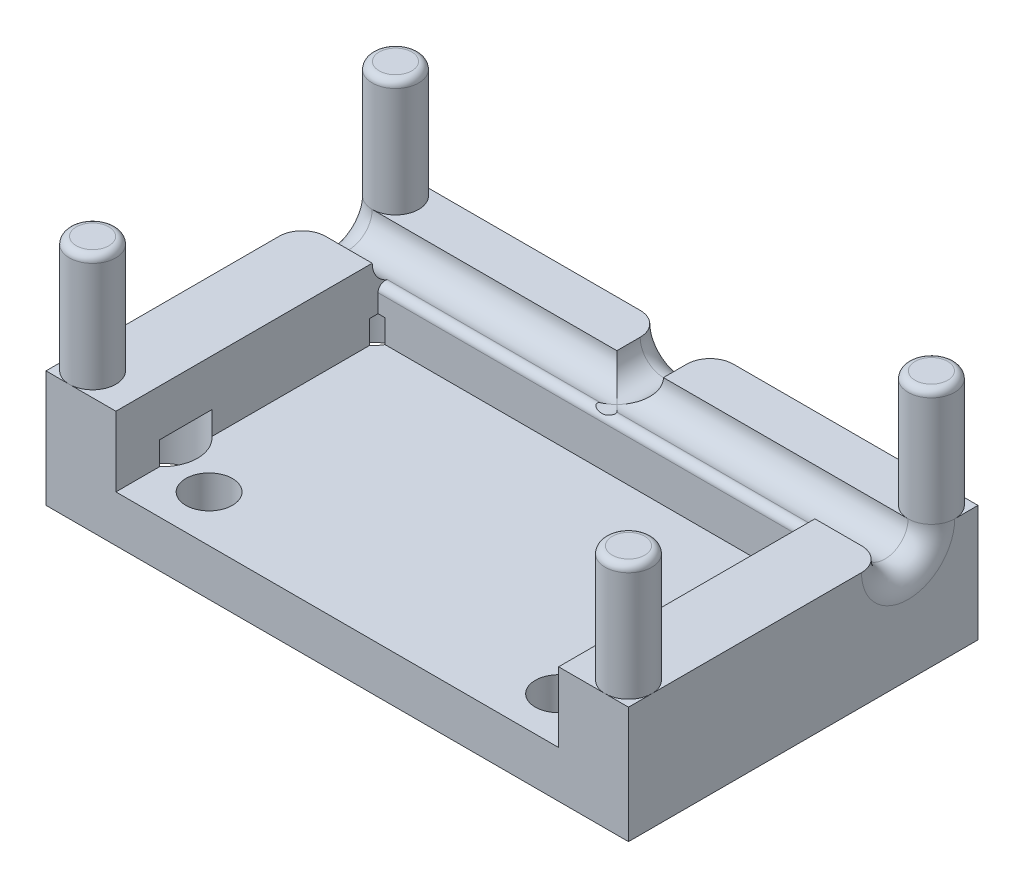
SolidWorks part; units mm, degrees
ref_plane "Front Plane" through (0, 0, 0) normal (0, 0, 1) x (1, 0, 0)
ref_plane "Top Plane" through (0, 0, 0) normal (0, 1, 0) x (1, 0, 0)
ref_plane "Right Plane" through (0, 0, 0) normal (1, 0, 0) x (0, 0, -1)
sketch "Sketch1" plane through (0, 0, 0) normal (0, 1, 0) x (1, 0, 0)
  line L1 (12.5, -7.5) -> (-12.5, -7.5)
  line L2 (12.5, -7.5) -> (12.5, 7.5)
  line L3 (12.5, 7.5) -> (-12.5, 7.5)
  line L4 (-12.5, -7.5) -> (-12.5, 7.5)
  line L5 (12.5, -7.5) -> (-12.5, 7.5) construction
  line L6 (12.5, 7.5) -> (-12.5, -7.5) construction
  point P0 (0, 0)
  dimension "D1" = 15
  dimension "D2" = 25
extrude "Boss-Extrude1" add sketch "Sketch1" along normal blind 5
sketch "Sketch2" plane through (-12.5, 0, 0) normal (-1, 0, 0) x (0, 0, 1)
  line L0 (-7.5, 5) -> (7.5, 5) construction
  circle A0 centre (-4.5, 5) radius 1
  dimension "D1" = 3
  dimension "D2" = 2
extrude "Cut-Extrude1" cut sketch "Sketch2" against normal through all both and the other way through all
fillet "Fillet1" radius 1 2 edges at (12.5, 4, -4.5) (-12.5, 4, -4.5)
sketch "Sketch3" plane through (0, 5, 0) normal (0, 1, 0) x (1, 0, 0)
  line L0 (0, 0) -> (0, 0.8963) construction
  line L1 (0, 0.8963) -> (0, 0) construction
  line L2 (0, 0) -> (1.0417, 0) construction
  line L3 (-12.5, 7.5) -> (-12.5, 6.5) construction
  line L4 (12.5, 7.5) -> (-12.5, 7.5) construction
  circle A0 centre (-11.5, 6.5) radius 1
  circle A1 centre (11.5, 6.5) radius 1
  circle A2 centre (11.5, -6.5) radius 1
  circle A3 centre (-11.5, -6.5) radius 1
  dimension "D3" = 2
  dimension "D1" = 1
  dimension "D2" = 1
extrude "Boss-Extrude2" add sketch "Sketch3" along normal blind 5
sketch "Sketch4" plane through (0, 5, 0) normal (0, 1, 0) x (1, 0, 0)
  line L0 (-9.5, -7.5) -> (9.5, -7.5)
  line L1 (-9.5, -7.5) -> (-9.5, 3.75)
  line L2 (9.5, -7.5) -> (9.5, 3.75)
  line L3 (-9.5, 3.75) -> (9.5, 3.75)
  line L4 (-11.5, -7.5) -> (11.5, -7.5) construction
  line L6 (11.5, 5.5) -> (-11.5, 5.5) construction
  dimension "D1" = 3
  dimension "D2" = 3
  dimension "D3" = 1.75
extrude "Cut-Extrude2" cut sketch "Sketch4" against normal blind 3
sketch "Sketch5" plane through (0, 2, 0) normal (0, 1, 0) x (1, 0, 0)
  line L0 (-9.5, 3.75) -> (-9.5, -7.5) construction
  line L1 (-9.5, -7.5) -> (9.5, -7.5) construction
  line L2 (0, 0) -> (0, -0.5929) construction
  circle A0 centre (-7.5, -5.5) radius 1
  circle A1 centre (7.5, -5.5) radius 1
  dimension "D1" = 2
  dimension "D2" = 2
  dimension "D3" = 2
extrude "Cut-Extrude3" cut sketch "Sketch5" against normal blind 3
fillet "Fillet2" radius 0.3 4 edges at (11.5, 10, 7.5) (11.5, 10, -7.5) (-11.5, 10, -5.5) (-11.5, 10, 5.5)
fillet "Fillet3" radius 0.3 1 edges at (0, 4.3386, -3.75)
sketch "Sketch6" plane through (0, 0, 0) normal (0, -1, 0) x (1, 0, 0)
  line L0 (-12.5, -7.5) -> (-12.5, 7.5) construction
  line L1 (-12.5, 7.5) -> (12.5, 7.5) construction
  line L2 (0, 0) -> (0, 1.6639) construction
  line L3 (0, 1.6639) -> (0, 0) construction
  line L4 (0, 0) -> (1.2397, 0) construction
  circle A0 centre (-10.5, 4.5) radius 1.5
  circle A1 centre (10.5, 4.5) radius 1.5
  circle A2 centre (10.5, -4.5) radius 1.5
  circle A3 centre (-10.5, -4.5) radius 1.5
  dimension "D1" = 3
  dimension "D2" = 2
  dimension "D3" = 3
extrude "Cut-Extrude4" cut sketch "Sketch6" against normal blind 3 and the other way through all
sketch "Sketch7" plane through (0, 0, -7.5) normal (0, 0, -1) x (-1, 0, 0)
  line L0 (-11.5, 5) -> (11.5, 5) construction
  circle A0 centre (0, 5) radius 1
extrude "Cut-Extrude5" cut sketch "Sketch7" against normal through all both and the other way through all
fillet "Fillet4" radius 1 1 edges at (0, 4, -7.5)
